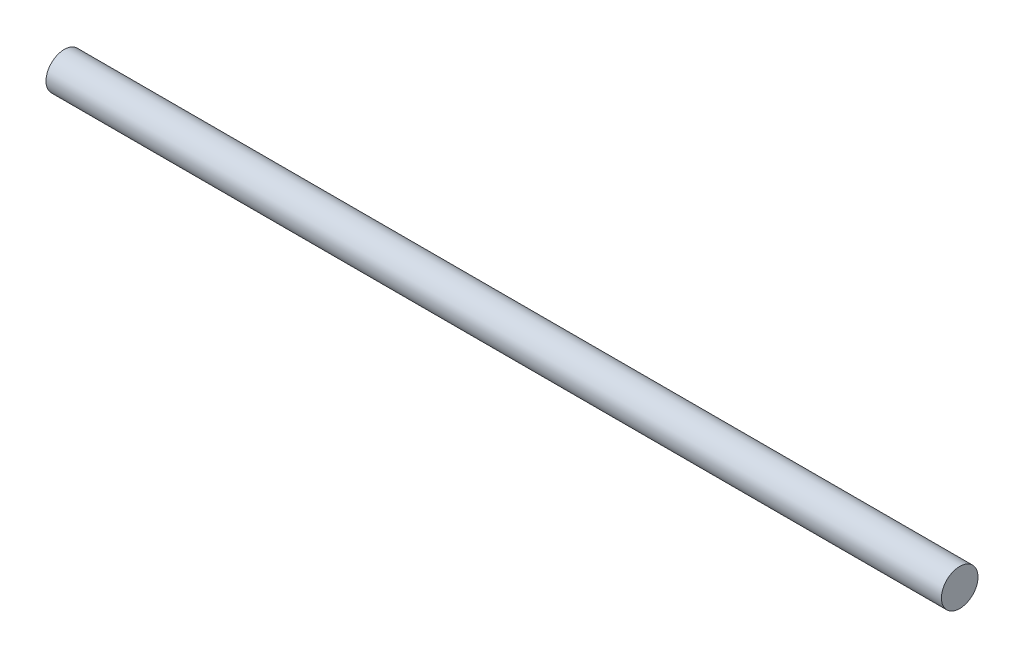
SolidWorks part; units mm, degrees
ref_plane "Plan de face" through (0, 0, 0) normal (0, 0, 1) x (1, 0, 0)
ref_plane "Plan de dessus" through (0, 0, 0) normal (0, 1, 0) x (1, 0, 0)
ref_plane "Plan de droite" through (0, 0, 0) normal (1, 0, 0) x (0, 0, -1)
sketch "Esquisse1" plane through (0, 0, 0) normal (0, 0, 1) x (1, 0, 0)
  line L0 (229.7305, -139) -> (31.0542, -139) construction
  line L2 (23.0448, -139) -> (23.0448, -137)
  line L3 (23.0448, -137) -> (120.9177, -137)
  line L4 (120.9177, -137) -> (120.9177, -139)
  line L5 (23.0448, -139) -> (120.9177, -139)
revolve "Révolution1" add sketch "Esquisse1" angle 360 about L0
